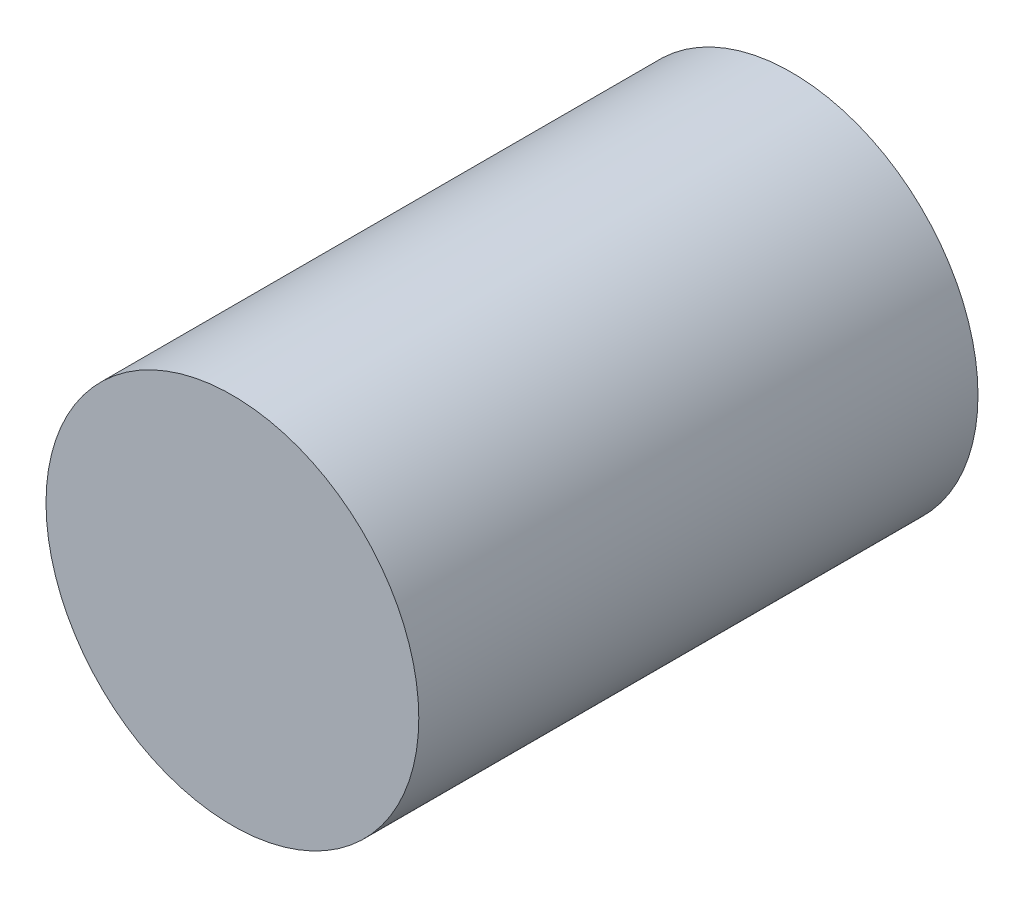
SolidWorks part; units mm, degrees
ref_plane "Front Plane" through (0, 0, 0) normal (0, 0, 1) x (1, 0, 0)
ref_plane "Top Plane" through (0, 0, 0) normal (0, 1, 0) x (1, 0, 0)
ref_plane "Right Plane" through (0, 0, 0) normal (1, 0, 0) x (0, 0, -1)
sketch "Sketch2" plane through (0, 0, 0) normal (0, 0, 1) x (1, 0, 0)
  circle A0 centre (0, 0) radius 5.08
extrude "Boss-Extrude1" add sketch "Sketch2" along normal blind 15.24
